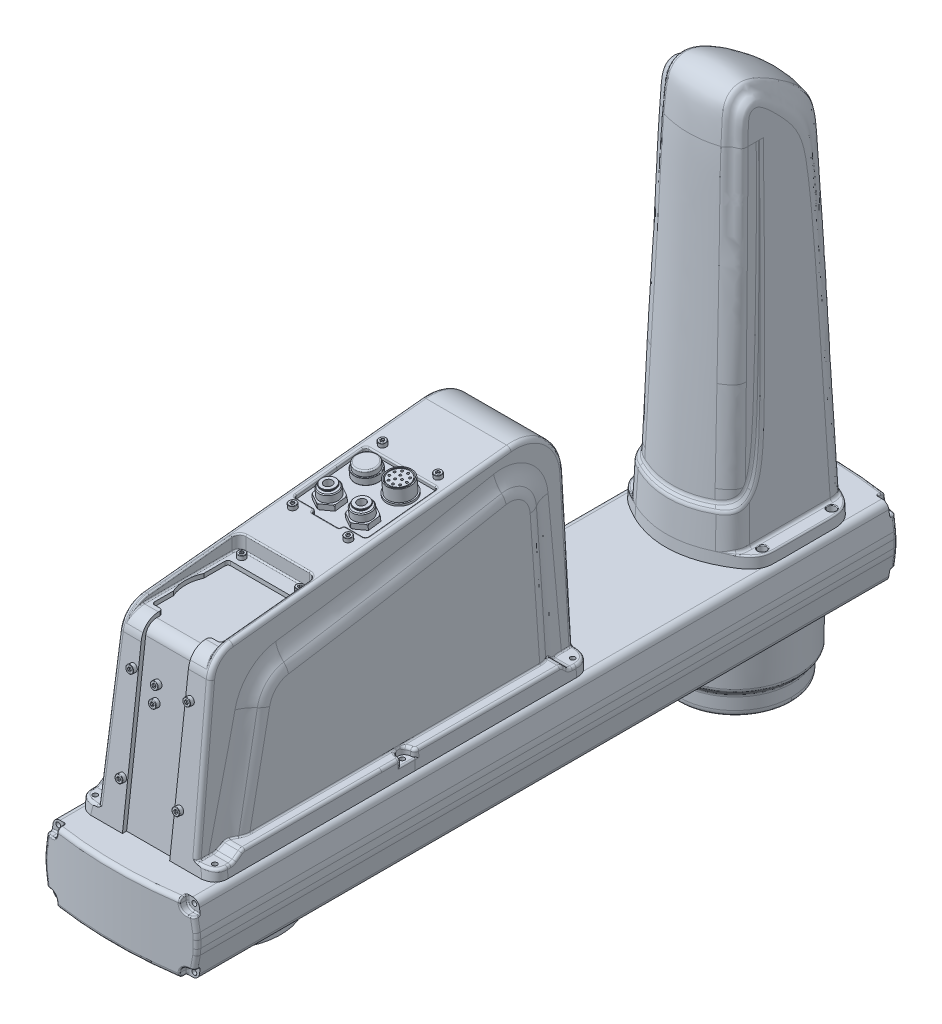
SolidWorks part; units mm, degrees
ref_plane "前视基准面" through (0, 0, 0) normal (0, 0, 1) x (1, 0, 0)
ref_plane "上视基准面" through (0, 0, 0) normal (0, 1, 0) x (1, 0, 0)
ref_plane "右视基准面" through (0, 0, 0) normal (1, 0, 0) x (0, 0, -1)
imported_body "MB10SC-800 外发模型-J3-1-solid1"
imported_body "J3新外壳-1-solid1"
other "移动面1" parameters "D1"=10
